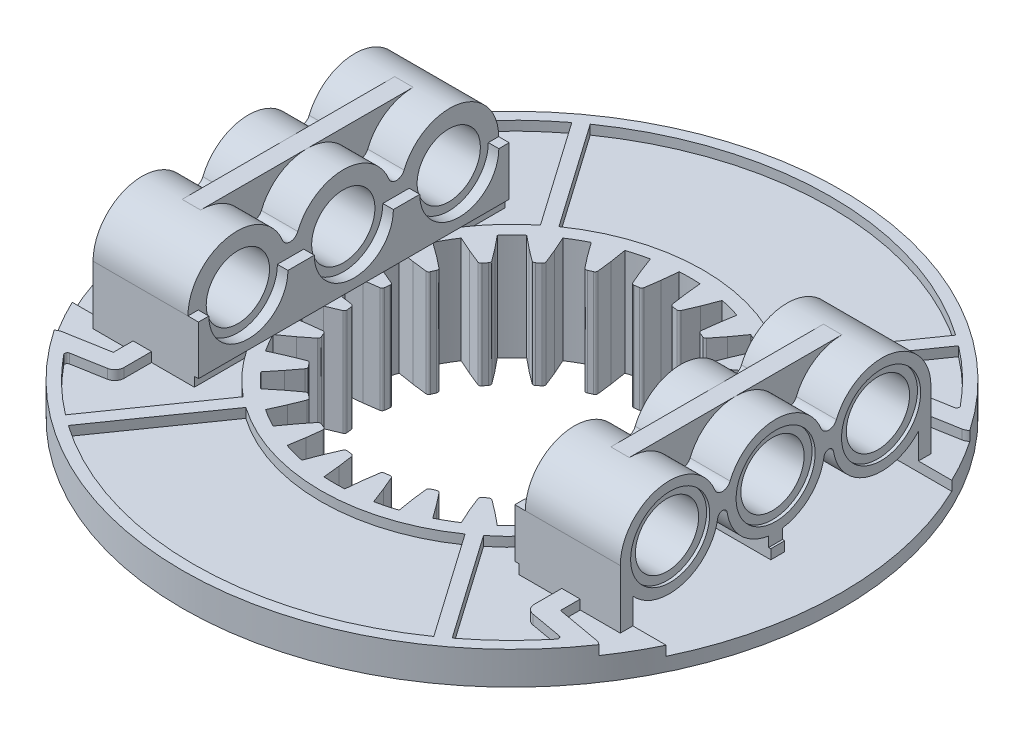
SolidWorks part; units mm, degrees
ref_plane "정면" through (0, 0, 0) normal (0, 0, 1) x (1, 0, 0)
ref_plane "윗면" through (0, 0, 0) normal (0, 1, 0) x (1, 0, 0)
ref_plane "우측면" through (0, 0, 0) normal (1, 0, 0) x (0, 0, -1)
imported_body "불러온 피처3"
sketch "스케치1" plane through (0, 6.21, 0) normal (0, 1, 0) x (-1, 0, 0)
  line L0 (-20.1625, -11.785) -> (-20.1625, 11.785)
  line L1 (-20.1625, 11.785) -> (-16.9625, 11.785)
  line L2 (-16.9625, 11.785) -> (-16.9625, 13.285)
  line L3 (-16.9625, 13.285) -> (-20.2821, 13.8745)
  line L4 (-20.7271, 14.9737) -> (-22.2268, 14.9737)
  line L5 (-22.2268, -14.9737) -> (-20.7271, -14.9737)
  line L6 (-20.2821, -13.8745) -> (-16.9625, -13.285)
  line L7 (-16.9625, -13.285) -> (-16.9625, -11.785)
  line L8 (-16.9625, -11.785) -> (-20.1625, -11.785)
  arc A0 (-20.2821, 13.8745) -> (-20.7271, 14.9737) centre (-20.1597, 14.5637) cw
  arc A1 (-22.2268, 14.9737) -> (-22.2268, -14.9737) centre (0, 0) ccw
  arc A2 (-20.7271, -14.9737) -> (-20.2821, -13.8745) centre (-20.1597, -14.5637) cw
extrude "컷-돌출1" cut sketch "스케치1" against normal blind 4.44
sketch "스케치2" plane through (0, 6.21, 0) normal (0, 1, 0) x (-1, 0, 0)
  line L0 (20.2821, 13.8745) -> (16.9625, 13.285)
  line L1 (16.9625, 13.285) -> (16.9625, 11.785)
  line L2 (16.9625, 11.785) -> (20.1625, 11.785)
  line L3 (20.1625, 11.785) -> (20.1625, -11.785)
  line L4 (20.1625, -11.785) -> (16.9625, -11.785)
  line L5 (16.9625, -11.785) -> (16.9625, -13.285)
  line L6 (16.9625, -13.285) -> (20.2821, -13.8745)
  line L7 (20.7271, -14.9737) -> (22.2268, -14.9737)
  line L8 (22.2268, 14.9737) -> (20.7271, 14.9737)
  arc A0 (20.7271, 14.9737) -> (20.2821, 13.8745) centre (20.1597, 14.5637) cw
  arc A1 (20.2821, -13.8745) -> (20.7271, -14.9737) centre (20.1597, -14.5637) cw
  arc A2 (22.2268, -14.9737) -> (22.2268, 14.9737) centre (0, 0) ccw
extrude "컷-돌출2" cut sketch "스케치2" against normal blind 4.44
sketch "스케치3" plane through (0, 6.21, 0) normal (0, 1, 0) x (-1, 0, 0)
  line L0 (-12.3125, -4.1719) -> (-12.3125, -11.785)
  line L1 (-12.3125, -11.785) -> (-16.9625, -11.785)
  line L2 (-16.9625, -11.785) -> (-16.9625, -13.285)
  line L3 (-16.9625, -13.285) -> (-20.2821, -13.8745)
  line L4 (-20.7271, -14.9737) -> (-22.2268, -14.9737)
  line L5 (22.2268, -14.9737) -> (20.7271, -14.9737)
  line L6 (20.2821, -13.8745) -> (16.9625, -13.285)
  line L7 (16.9625, -13.285) -> (16.9625, -11.785)
  line L8 (16.9625, -11.785) -> (12.3125, -11.785)
  line L9 (12.3125, -11.785) -> (12.3125, -4.1719)
  line L10 (12.3125, -4.1719) -> (11.5606, -4.0516)
  line L11 (11.5606, -4.0516) -> (10.2898, -3.895)
  line L12 (10.2898, -3.895) -> (10.0367, -4.521)
  line L13 (10.0367, -4.521) -> (11.0395, -5.3096)
  line L14 (11.0395, -5.3096) -> (12.0667, -6.0535)
  line L15 (11.2758, -7.4233) -> (10.118, -6.9057)
  line L16 (10.118, -6.9057) -> (8.9311, -6.4255)
  line L17 (8.9311, -6.4255) -> (8.5246, -6.9647)
  line L18 (8.5246, -6.9647) -> (9.2891, -7.9859)
  line L19 (9.2891, -7.9859) -> (10.0888, -8.9703)
  line L20 (8.9703, -10.0888) -> (7.9859, -9.2891)
  line L21 (7.9859, -9.2891) -> (6.9638, -8.5181)
  line L22 (6.9638, -8.5181) -> (6.4315, -8.9337)
  line L23 (6.4315, -8.9337) -> (6.9057, -10.118)
  line L24 (6.9057, -10.118) -> (7.4233, -11.2758)
  line L25 (6.0535, -12.0667) -> (5.3096, -11.0395)
  line L26 (5.3096, -11.0395) -> (4.5218, -10.0302)
  line L27 (4.5218, -10.0302) -> (3.9002, -10.2939)
  line L28 (3.9002, -10.2939) -> (4.0516, -11.5606)
  line L29 (4.0516, -11.5606) -> (4.252, -12.8129)
  line L30 (2.7242, -13.2223) -> (2.2715, -12.0376)
  line L31 (2.2715, -12.0376) -> (1.7717, -10.8588)
  line L32 (1.7717, -10.8588) -> (1.103, -10.9526)
  line L33 (1.103, -10.9526) -> (0.9215, -12.2153)
  line L34 (0.9215, -12.2153) -> (0.7908, -13.4768)
  line L35 (-0.7908, -13.4768) -> (-0.9215, -12.2153)
  line L36 (-0.9215, -12.2153) -> (-1.0991, -10.9473)
  line L37 (-1.0991, -10.9473) -> (-1.7693, -10.8649)
  line L38 (-1.7693, -10.8649) -> (-2.2715, -12.0376)
  line L39 (-2.2715, -12.0376) -> (-2.7242, -13.2223)
  line L40 (-4.252, -12.8129) -> (-4.0516, -11.5606)
  line L41 (-4.0516, -11.5606) -> (-3.895, -10.2898)
  line L42 (-3.895, -10.2898) -> (-4.521, -10.0367)
  line L43 (-4.521, -10.0367) -> (-5.3096, -11.0395)
  line L44 (-5.3096, -11.0395) -> (-6.0535, -12.0667)
  line L45 (-7.4233, -11.2758) -> (-6.9057, -10.118)
  line L46 (-6.9057, -10.118) -> (-6.4255, -8.9311)
  line L47 (-6.4255, -8.9311) -> (-6.9647, -8.5246)
  line L48 (-6.9647, -8.5246) -> (-7.9859, -9.2891)
  line L49 (-7.9859, -9.2891) -> (-8.9703, -10.0888)
  line L50 (-10.0888, -8.9703) -> (-9.2891, -7.9859)
  line L51 (-9.2891, -7.9859) -> (-8.5181, -6.9638)
  line L52 (-8.5181, -6.9638) -> (-8.9337, -6.4315)
  line L53 (-8.9337, -6.4315) -> (-10.118, -6.9057)
  line L54 (-10.118, -6.9057) -> (-11.2758, -7.4233)
  line L55 (-12.0667, -6.0535) -> (-11.0395, -5.3096)
  line L56 (-11.0395, -5.3096) -> (-10.0302, -4.5218)
  line L57 (-10.0302, -4.5218) -> (-10.2939, -3.9002)
  line L58 (-10.2939, -3.9002) -> (-11.5606, -4.0516)
  line L59 (-11.5606, -4.0516) -> (-12.3125, -4.1719)
  arc A0 (-20.2821, -13.8745) -> (-20.7271, -14.9737) centre (-20.1597, -14.5637) ccw
  arc A1 (-22.2268, -14.9737) -> (22.2268, -14.9737) centre (0, 0) ccw
  arc A2 (20.7271, -14.9737) -> (20.2821, -13.8745) centre (20.1597, -14.5637) ccw
  arc A3 (12.0667, -6.0535) -> (11.2758, -7.4233) centre (0, 0) cw
  arc A4 (10.0888, -8.9703) -> (8.9703, -10.0888) centre (0, 0) cw
  arc A5 (7.4233, -11.2758) -> (6.0535, -12.0667) centre (0, 0) cw
  arc A6 (4.252, -12.8129) -> (2.7242, -13.2223) centre (0, 0) cw
  arc A7 (0.7908, -13.4768) -> (-0.7908, -13.4768) centre (0, 0) cw
  arc A8 (-2.7242, -13.2223) -> (-4.252, -12.8129) centre (0, 0) cw
  arc A9 (-6.0535, -12.0667) -> (-7.4233, -11.2758) centre (0, 0) cw
  arc A10 (-8.9703, -10.0888) -> (-10.0888, -8.9703) centre (0, 0) cw
  arc A11 (-11.2758, -7.4233) -> (-12.0667, -6.0535) centre (0, 0) cw
extrude "컷-돌출3" cut sketch "스케치3" against normal blind 3.72
sketch "스케치4" plane through (0, 6.21, 0) normal (0, 1, 0) x (-1, 0, 0)
  line L0 (-16.9625, 11.785) -> (-12.3125, 11.785)
  line L1 (-12.3125, 11.785) -> (-12.3125, 4.1719)
  line L2 (-12.3125, 4.1719) -> (-11.5606, 4.0516)
  line L3 (-11.5606, 4.0516) -> (-10.2898, 3.895)
  line L4 (-10.2898, 3.895) -> (-10.0367, 4.521)
  line L5 (-10.0367, 4.521) -> (-11.0395, 5.3096)
  line L6 (-11.0395, 5.3096) -> (-12.0667, 6.0535)
  line L7 (-11.2758, 7.4233) -> (-10.118, 6.9057)
  line L8 (-10.118, 6.9057) -> (-8.9311, 6.4255)
  line L9 (-8.9311, 6.4255) -> (-8.5246, 6.9647)
  line L10 (-8.5246, 6.9647) -> (-9.2891, 7.9859)
  line L11 (-9.2891, 7.9859) -> (-10.0888, 8.9703)
  line L12 (-8.9703, 10.0888) -> (-7.9859, 9.2891)
  line L13 (-7.9859, 9.2891) -> (-6.9638, 8.5181)
  line L14 (-6.9638, 8.5181) -> (-6.4315, 8.9337)
  line L15 (-6.4315, 8.9337) -> (-6.9057, 10.118)
  line L16 (-6.9057, 10.118) -> (-7.4233, 11.2758)
  line L17 (-6.0535, 12.0667) -> (-5.3096, 11.0395)
  line L18 (-5.3096, 11.0395) -> (-4.5218, 10.0302)
  line L19 (-4.5218, 10.0302) -> (-3.9002, 10.2939)
  line L20 (-3.9002, 10.2939) -> (-4.0516, 11.5606)
  line L21 (-4.0516, 11.5606) -> (-4.252, 12.8129)
  line L22 (-2.7242, 13.2223) -> (-2.2715, 12.0376)
  line L23 (-2.2715, 12.0376) -> (-1.7717, 10.8588)
  line L24 (-1.7717, 10.8588) -> (-1.103, 10.9526)
  line L25 (-1.103, 10.9526) -> (-0.9215, 12.2153)
  line L26 (-0.9215, 12.2153) -> (-0.7908, 13.4768)
  line L27 (0.7908, 13.4768) -> (0.9215, 12.2153)
  line L28 (0.9215, 12.2153) -> (1.0991, 10.9473)
  line L29 (1.0991, 10.9473) -> (1.7693, 10.8649)
  line L30 (1.7693, 10.8649) -> (2.2715, 12.0376)
  line L31 (2.2715, 12.0376) -> (2.7242, 13.2223)
  line L32 (4.252, 12.8129) -> (4.0516, 11.5606)
  line L33 (4.0516, 11.5606) -> (3.895, 10.2898)
  line L34 (3.895, 10.2898) -> (4.521, 10.0367)
  line L35 (4.521, 10.0367) -> (5.3096, 11.0395)
  line L36 (5.3096, 11.0395) -> (6.0535, 12.0667)
  line L37 (7.4233, 11.2758) -> (6.9057, 10.118)
  line L38 (6.9057, 10.118) -> (6.4255, 8.9311)
  line L39 (6.4255, 8.9311) -> (6.9647, 8.5246)
  line L40 (6.9647, 8.5246) -> (7.9859, 9.2891)
  line L41 (7.9859, 9.2891) -> (8.9703, 10.0888)
  line L42 (10.0888, 8.9703) -> (9.2891, 7.9859)
  line L43 (9.2891, 7.9859) -> (8.5181, 6.9638)
  line L44 (8.5181, 6.9638) -> (8.9337, 6.4315)
  line L45 (8.9337, 6.4315) -> (10.118, 6.9057)
  line L46 (10.118, 6.9057) -> (11.2758, 7.4233)
  line L47 (12.0667, 6.0535) -> (11.0395, 5.3096)
  line L48 (11.0395, 5.3096) -> (10.0302, 4.5218)
  line L49 (10.0302, 4.5218) -> (10.2939, 3.9002)
  line L50 (10.2939, 3.9002) -> (11.5606, 4.0516)
  line L51 (11.5606, 4.0516) -> (12.3125, 4.1719)
  line L52 (12.3125, 4.1719) -> (12.3125, 11.785)
  line L53 (12.3125, 11.785) -> (16.9625, 11.785)
  line L54 (16.9625, 11.785) -> (16.9625, 13.285)
  line L55 (16.9625, 13.285) -> (20.2821, 13.8745)
  line L56 (20.7271, 14.9737) -> (22.2268, 14.9737)
  line L57 (-22.2268, 14.9737) -> (-20.7271, 14.9737)
  line L58 (-20.2821, 13.8745) -> (-16.9625, 13.285)
  line L59 (-16.9625, 13.285) -> (-16.9625, 11.785)
  arc A0 (-12.0667, 6.0535) -> (-11.2758, 7.4233) centre (0, 0) cw
  arc A1 (-10.0888, 8.9703) -> (-8.9703, 10.0888) centre (0, 0) cw
  arc A2 (-7.4233, 11.2758) -> (-6.0535, 12.0667) centre (0, 0) cw
  arc A3 (-4.252, 12.8129) -> (-2.7242, 13.2223) centre (0, 0) cw
  arc A4 (-0.7908, 13.4768) -> (0.7908, 13.4768) centre (0, 0) cw
  arc A5 (2.7242, 13.2223) -> (4.252, 12.8129) centre (0, 0) cw
  arc A6 (6.0535, 12.0667) -> (7.4233, 11.2758) centre (0, 0) cw
  arc A7 (8.9703, 10.0888) -> (10.0888, 8.9703) centre (0, 0) cw
  arc A8 (11.2758, 7.4233) -> (12.0667, 6.0535) centre (0, 0) cw
  arc A9 (20.2821, 13.8745) -> (20.7271, 14.9737) centre (20.1597, 14.5637) ccw
  arc A10 (22.2268, 14.9737) -> (-22.2268, 14.9737) centre (0, 0) ccw
  arc A11 (-20.7271, 14.9737) -> (-20.2821, 13.8745) centre (-20.1597, 14.5637) ccw
extrude "컷-돌출4" cut sketch "스케치4" against normal blind 3.72
sketch "스케치5" plane through (0, -5.575, 0) normal (0, -1, 0) x (1, 0, 0)
  line L0 (12.8129, 4.252) -> (12.3125, 4.1719)
  line L1 (12.3125, 4.1719) -> (12.3125, 2.3765)
  line L2 (12.3125, 2.3765) -> (13.2223, 2.7242)
  arc A0 (13.2223, 2.7242) -> (12.8129, 4.252) centre (0, 0) ccw
extrude "컷-돌출5" cut sketch "스케치5" against normal blind 8.065
sketch "스케치6" plane through (-12.3125, 0, 0) normal (1, 0, 0) x (0, 0, -1)
  line L0 (0, 9.93) -> (-8.065, 9.93)
  arc A0 (-8.065, 9.93) -> (-4.6127, 7.5956) centre (-8.065, 6.21) cw
  arc A1 (-4.6127, 7.5956) -> (-3.4523, 7.5956) centre (-4.0325, 7.8285) ccw
  arc A2 (-3.4523, 7.5956) -> (0, 9.93) centre (0, 6.21) cw
extrude "컷-돌출6" cut sketch "스케치6" against normal blind 3.25
sketch "스케치7" plane through (12.3125, 0, 0) normal (-1, 0, 0) x (0, 0, 1)
  line L0 (8.065, 9.93) -> (0, 9.93)
  arc A0 (4.6127, 7.5956) -> (8.065, 9.93) centre (8.065, 6.21) cw
  arc A1 (0, 9.93) -> (3.4523, 7.5956) centre (0, 6.21) cw
  arc A2 (3.4523, 7.5956) -> (4.6127, 7.5956) centre (4.0325, 7.8285) ccw
extrude "컷-돌출7" cut sketch "스케치7" against normal blind 3.25
sketch "스케치8" plane through (20.1625, 0, 0) normal (1, 0, 0) x (0, 0, -1)
  line L0 (0, 9.93) -> (-8.065, 9.93)
  arc A0 (-8.065, 9.93) -> (-4.6127, 7.5956) centre (-8.065, 6.21) cw
  arc A1 (-4.6127, 7.5956) -> (-3.4523, 7.5956) centre (-4.0325, 7.8285) ccw
  arc A2 (-3.4523, 7.5956) -> (0, 9.93) centre (0, 6.21) cw
extrude "컷-돌출8" cut sketch "스케치8" against normal blind 3.2
sketch "스케치9" plane through (-12.3125, 0, 0) normal (1, 0, 0) x (0, 0, -1)
  line L0 (8.065, 9.93) -> (0, 9.93)
  arc A0 (0, 9.93) -> (3.4523, 7.5956) centre (0, 6.21) cw
  arc A1 (3.4523, 7.5956) -> (4.6127, 7.5956) centre (4.0325, 7.8285) ccw
  arc A2 (4.6127, 7.5956) -> (8.065, 9.93) centre (8.065, 6.21) cw
extrude "컷-돌출9" cut sketch "스케치9" against normal blind 3.25
sketch "스케치10" plane through (-20.1625, 0, 0) normal (-1, 0, 0) x (0, 0, 1)
  line L0 (0, 9.93) -> (-8.065, 9.93)
  arc A0 (-3.4523, 7.5956) -> (0, 9.93) centre (0, 6.21) cw
  arc A1 (-8.065, 9.93) -> (-4.6127, 7.5956) centre (-8.065, 6.21) cw
  arc A2 (-4.6127, 7.5956) -> (-3.4523, 7.5956) centre (-4.0325, 7.8285) ccw
extrude "컷-돌출10" cut sketch "스케치10" against normal blind 3.2
sketch "스케치11" plane through (20.1625, 0, 0) normal (1, 0, 0) x (0, 0, -1)
  line L0 (8.065, 9.93) -> (0, 9.93)
  arc A0 (0, 9.93) -> (3.4523, 7.5956) centre (0, 6.21) cw
  arc A1 (3.4523, 7.5956) -> (4.6127, 7.5956) centre (4.0325, 7.8285) ccw
  arc A2 (4.6127, 7.5956) -> (8.065, 9.93) centre (8.065, 6.21) cw
extrude "컷-돌출11" cut sketch "스케치11" against normal blind 3.2
sketch "스케치12" plane through (12.3125, 0, 0) normal (-1, 0, 0) x (0, 0, 1)
  line L0 (0, 9.93) -> (-8.065, 9.93)
  arc A0 (-3.4523, 7.5956) -> (0, 9.93) centre (0, 6.21) cw
  arc A1 (-8.065, 9.93) -> (-4.6127, 7.5956) centre (-8.065, 6.21) cw
  arc A2 (-4.6127, 7.5956) -> (-3.4523, 7.5956) centre (-4.0325, 7.8285) ccw
extrude "컷-돌출12" cut sketch "스케치12" against normal blind 3.25
sketch "스케치13" plane through (0, -5.575, 0) normal (0, -1, 0) x (1, 0, 0)
  line L0 (13.4768, 0.7908) -> (12.3125, 0.9114)
  line L1 (12.3125, 0.9114) -> (12.3125, -0.9114)
  line L2 (12.3125, -0.9114) -> (13.4768, -0.7908)
  arc A0 (13.4768, -0.7908) -> (13.4768, 0.7908) centre (0, 0) ccw
extrude "컷-돌출13" cut sketch "스케치13" against normal blind 8.065
sketch "스케치14" plane through (0, -5.575, 0) normal (0, -1, 0) x (1, 0, 0)
  line L0 (13.2223, -2.7242) -> (12.3125, -2.3765)
  line L1 (12.3125, -2.3765) -> (12.3125, -4.1719)
  line L2 (12.3125, -4.1719) -> (12.8129, -4.252)
  arc A0 (12.8129, -4.252) -> (13.2223, -2.7242) centre (0, 0) ccw
extrude "컷-돌출14" cut sketch "스케치14" against normal blind 8.065
sketch "스케치15" plane through (0, -5.575, 0) normal (0, -1, 0) x (1, 0, 0)
  line L0 (-12.8129, -4.252) -> (-12.3125, -4.1719)
  line L1 (-12.3125, -4.1719) -> (-12.3125, -2.3765)
  line L2 (-12.3125, -2.3765) -> (-13.2223, -2.7242)
  arc A0 (-13.2223, -2.7242) -> (-12.8129, -4.252) centre (0, 0) ccw
extrude "컷-돌출15" cut sketch "스케치15" against normal blind 8.065
sketch "스케치16" plane through (0, -5.575, 0) normal (0, -1, 0) x (1, 0, 0)
  line L0 (-13.4768, -0.7908) -> (-12.3125, -0.9114)
  line L1 (-12.3125, -0.9114) -> (-12.3125, 0.9114)
  line L2 (-12.3125, 0.9114) -> (-13.4768, 0.7908)
  arc A0 (-13.4768, 0.7908) -> (-13.4768, -0.7908) centre (0, 0) ccw
extrude "컷-돌출16" cut sketch "스케치16" against normal blind 8.065
sketch "스케치17" plane through (0, -5.575, 0) normal (0, -1, 0) x (1, 0, 0)
  line L0 (-13.2223, 2.7242) -> (-12.3125, 2.3765)
  line L1 (-12.3125, 2.3765) -> (-12.3125, 4.1719)
  line L2 (-12.3125, 4.1719) -> (-12.8129, 4.252)
  arc A0 (-12.8129, 4.252) -> (-13.2223, 2.7242) centre (0, 0) ccw
extrude "컷-돌출17" cut sketch "스케치17" against normal blind 8.065
sketch "스케치18" plane through (-20.1625, 0, 0) normal (-1, 0, 0) x (0, 0, 1)
  line L0 (8.065, 9.93) -> (0, 9.93)
  arc A0 (4.6127, 7.5956) -> (8.065, 9.93) centre (8.065, 6.21) cw
  arc A1 (0, 9.93) -> (3.4523, 7.5956) centre (0, 6.21) cw
  arc A2 (3.4523, 7.5956) -> (4.6127, 7.5956) centre (4.0325, 7.8285) ccw
extrude "컷-돌출18" cut sketch "스케치18" against normal blind 3.2
sketch "스케치19" plane through (-12.3125, 0, 0) normal (1, 0, 0) x (0, 0, -1)
  line L0 (-11.7086, 6.96) -> (11.7086, 6.96)
  arc A0 (-4.6127, 7.5956) -> (-11.7086, 6.96) centre (-8.065, 6.21) ccw
  arc A1 (11.7086, 6.96) -> (4.6127, 7.5956) centre (8.065, 6.21) ccw
  arc A2 (4.6127, 7.5956) -> (3.4523, 7.5956) centre (4.0325, 7.8285) cw
  arc A3 (3.4523, 7.5956) -> (-3.4523, 7.5956) centre (0, 6.21) ccw
  arc A4 (-3.4523, 7.5956) -> (-4.6127, 7.5956) centre (-4.0325, 7.8285) cw
extrude "컷-돌출19" cut sketch "스케치19" against normal blind 0.0875
sketch "스케치20" plane through (12.3125, 0, 0) normal (-1, 0, 0) x (0, 0, 1)
  line L0 (-11.7086, 6.96) -> (11.7086, 6.96)
  arc A0 (-4.6127, 7.5956) -> (-11.7086, 6.96) centre (-8.065, 6.21) ccw
  arc A1 (11.7086, 6.96) -> (4.6127, 7.5956) centre (8.065, 6.21) ccw
  arc A2 (4.6127, 7.5956) -> (3.4523, 7.5956) centre (4.0325, 7.8285) cw
  arc A3 (3.4523, 7.5956) -> (-3.4523, 7.5956) centre (0, 6.21) ccw
  arc A4 (-3.4523, 7.5956) -> (-4.6127, 7.5956) centre (-4.0325, 7.8285) cw
extrude "컷-돌출20" cut sketch "스케치20" against normal blind 0.0875
sketch "스케치21" plane through (0, 2.49, 0) normal (0, 1, 0) x (-1, 0, 0)
  line L0 (-14.6706, -19.2084) -> (-9.1162, -11.2758)
  line L1 (-12.3125, -7.6585) -> (-12.3125, -11.785)
  line L2 (-12.3125, -11.785) -> (-15.5625, -11.785)
  line L3 (-15.5625, -11.785) -> (-15.5625, -14.4583)
  line L4 (-15.5625, -14.4583) -> (-18.577, -14.9936)
  arc A0 (-18.6968, -15.3173) -> (-14.6706, -19.2084) centre (0, 0) ccw
  arc A1 (-9.1162, -11.2758) -> (-12.3125, -7.6585) centre (0, 0) cw
  arc A2 (-18.577, -14.9936) -> (-18.6968, -15.3173) centre (-18.5421, -15.1905) ccw
extrude "컷-돌출21" cut sketch "스케치21" against normal blind 0.72
sketch "스케치22" plane through (0, 2.49, 0) normal (0, 1, 0) x (-1, 0, 0)
  line L0 (-18.577, 14.9936) -> (-15.5625, 14.4583)
  line L1 (-15.5625, 14.4583) -> (-15.5625, 11.785)
  line L2 (-15.5625, 11.785) -> (-12.3125, 11.785)
  line L3 (-12.3125, 11.785) -> (-12.3125, 7.6585)
  line L4 (-9.1162, 11.2758) -> (-14.6706, 19.2084)
  arc A0 (-14.6706, 19.2084) -> (-18.6968, 15.3173) centre (0, 0) ccw
  arc A1 (-18.6968, 15.3173) -> (-18.577, 14.9936) centre (-18.5421, 15.1905) ccw
  arc A2 (-12.3125, 7.6585) -> (-9.1162, 11.2758) centre (0, 0) cw
extrude "컷-돌출22" cut sketch "스케치22" against normal blind 0.72
sketch "스케치23" plane through (0, 2.49, 0) normal (0, 1, 0) x (-1, 0, 0)
  line L0 (12.3125, 11.785) -> (15.5625, 11.785)
  line L1 (15.5625, 11.785) -> (15.5625, 14.4583)
  line L2 (15.5625, 14.4583) -> (18.577, 14.9936)
  line L3 (14.6706, 19.2084) -> (9.1162, 11.2758)
  line L4 (12.3125, 7.6585) -> (12.3125, 11.785)
  arc A0 (18.577, 14.9936) -> (18.6968, 15.3173) centre (18.5421, 15.1905) ccw
  arc A1 (18.6968, 15.3173) -> (14.6706, 19.2084) centre (0, 0) ccw
  arc A2 (9.1162, 11.2758) -> (12.3125, 7.6585) centre (0, 0) cw
extrude "컷-돌출23" cut sketch "스케치23" against normal blind 0.72
sketch "스케치24" plane through (0, 2.49, 0) normal (0, 1, 0) x (-1, 0, 0)
  line L0 (15.5625, -11.785) -> (12.3125, -11.785)
  line L1 (12.3125, -11.785) -> (12.3125, -7.6585)
  line L2 (9.1162, -11.2758) -> (14.6706, -19.2084)
  line L3 (18.577, -14.9936) -> (15.5625, -14.4583)
  line L4 (15.5625, -14.4583) -> (15.5625, -11.785)
  arc A0 (12.3125, -7.6585) -> (9.1162, -11.2758) centre (0, 0) cw
  arc A1 (14.6706, -19.2084) -> (18.6968, -15.3173) centre (0, 0) ccw
  arc A2 (18.6968, -15.3173) -> (18.577, -14.9936) centre (18.5421, -15.1905) ccw
extrude "컷-돌출24" cut sketch "스케치24" against normal blind 0.72
sketch "스케치25" plane through (0, 1.77, 0) normal (0, 1, 0) x (-1, 0, 0)
  line L0 (-20.1625, -10.835) -> (-20.1625, 10.835)
  line L1 (-20.1625, 10.835) -> (-24.5121, 10.835)
  line L2 (-24.5121, -10.835) -> (-20.1625, -10.835)
  arc A0 (-24.5121, 10.835) -> (-24.5121, -10.835) centre (0, 0) ccw
extrude "컷-돌출25" cut sketch "스케치25" against normal blind 0.73
sketch "스케치26" plane through (20.1625, 0, 0) normal (1, 0, 0) x (0, 0, -1)
  line L0 (-10.835, 1.04) -> (-0.53, 1.04)
  line L1 (-0.53, 1.04) -> (-0.53, 2.5279)
  line L2 (-10.835, 3.727) -> (-10.835, 1.04)
  arc A0 (-0.53, 2.5279) -> (-3.6768, 5.6448) centre (0, 6.21) cw
  arc A1 (-3.6768, 5.6448) -> (-4.3882, 5.6448) centre (-4.0325, 5.5901) ccw
  arc A2 (-4.3882, 5.6448) -> (-10.835, 3.727) centre (-8.065, 6.21) cw
extrude "컷-돌출26" cut sketch "스케치26" against normal blind 6
sketch "스케치27" plane through (20.1625, 0, 0) normal (1, 0, 0) x (0, 0, -1)
  line L0 (0.53, 1.04) -> (10.835, 1.04)
  line L1 (10.835, 1.04) -> (10.835, 3.727)
  line L2 (0.53, 2.5279) -> (0.53, 1.04)
  arc A0 (10.835, 3.727) -> (4.3882, 5.6448) centre (8.065, 6.21) cw
  arc A1 (4.3882, 5.6448) -> (3.6768, 5.6448) centre (4.0325, 5.5901) ccw
  arc A2 (3.6768, 5.6448) -> (0.53, 2.5279) centre (0, 6.21) cw
extrude "컷-돌출27" cut sketch "스케치27" against normal blind 6
sketch "스케치28" plane through (0, 1.77, 0) normal (0, 1, 0) x (-1, 0, 0)
  line L0 (24.5121, 10.835) -> (20.1625, 10.835)
  line L1 (20.1625, 10.835) -> (20.1625, -10.835)
  line L2 (20.1625, -10.835) -> (24.5121, -10.835)
  arc A0 (24.5121, -10.835) -> (24.5121, 10.835) centre (0, 0) ccw
extrude "컷-돌출28" cut sketch "스케치28" against normal blind 0.73
sketch "스케치29" plane through (-20.1625, 0, 0) normal (-1, 0, 0) x (0, 0, 1)
  line L0 (0.53, 2.5279) -> (0.53, 1.04)
  line L1 (0.53, 1.04) -> (10.835, 1.04)
  line L2 (10.835, 1.04) -> (10.835, 3.727)
  arc A0 (10.835, 3.727) -> (4.3882, 5.6448) centre (8.065, 6.21) cw
  arc A1 (4.3882, 5.6448) -> (3.6768, 5.6448) centre (4.0325, 5.5901) ccw
  arc A2 (3.6768, 5.6448) -> (0.53, 2.5279) centre (0, 6.21) cw
extrude "컷-돌출29" cut sketch "스케치29" against normal blind 6
sketch "스케치30" plane through (-20.1625, 0, 0) normal (-1, 0, 0) x (0, 0, 1)
  line L0 (-10.835, 1.04) -> (-0.53, 1.04)
  line L1 (-0.53, 1.04) -> (-0.53, 2.5279)
  line L2 (-10.835, 3.727) -> (-10.835, 1.04)
  arc A0 (-0.53, 2.5279) -> (-3.6768, 5.6448) centre (0, 6.21) cw
  arc A1 (-3.6768, 5.6448) -> (-4.3882, 5.6448) centre (-4.0325, 5.5901) ccw
  arc A2 (-4.3882, 5.6448) -> (-10.835, 3.727) centre (-8.065, 6.21) cw
extrude "컷-돌출30" cut sketch "스케치30" against normal blind 6
sketch "스케치31" plane through (-12.3125, 0, 0) normal (1, 0, 0) x (0, 0, -1)
  line L0 (-4.6463, 6.96) -> (-11.4837, 6.96)
  arc A0 (-11.4837, 6.96) -> (-4.6463, 6.96) centre (-8.065, 6.21) ccw
extrude "컷-돌출31" cut sketch "스케치31" against normal blind 0.0875
sketch "스케치32" plane through (-12.3125, 0, 0) normal (1, 0, 0) x (0, 0, -1)
  line L0 (2.9821, 6.96) -> (-2.9821, 6.96)
  arc A0 (-2.9821, 6.96) -> (2.9821, 6.96) centre (0, 6.21) ccw
extrude "컷-돌출32" cut sketch "스케치32" against normal blind 0.0875
sketch "스케치33" plane through (-12.3125, 0, 0) normal (1, 0, 0) x (0, 0, -1)
  line L0 (11.4837, 6.96) -> (4.6463, 6.96)
  arc A0 (4.6463, 6.96) -> (11.4837, 6.96) centre (8.065, 6.21) ccw
extrude "컷-돌출33" cut sketch "스케치33" against normal blind 0.0875
sketch "스케치34" plane through (12.3125, 0, 0) normal (-1, 0, 0) x (0, 0, 1)
  line L0 (-4.6463, 6.96) -> (-11.4837, 6.96)
  arc A0 (-11.4837, 6.96) -> (-4.6463, 6.96) centre (-8.065, 6.21) ccw
extrude "컷-돌출34" cut sketch "스케치34" against normal blind 0.0875
sketch "스케치35" plane through (12.3125, 0, 0) normal (-1, 0, 0) x (0, 0, 1)
  line L0 (2.9821, 6.96) -> (-2.9821, 6.96)
  arc A0 (-2.9821, 6.96) -> (2.9821, 6.96) centre (0, 6.21) ccw
extrude "컷-돌출35" cut sketch "스케치35" against normal blind 0.0875
sketch "스케치36" plane through (12.3125, 0, 0) normal (-1, 0, 0) x (0, 0, 1)
  line L0 (11.4837, 6.96) -> (4.6463, 6.96)
  arc A0 (4.6463, 6.96) -> (11.4837, 6.96) centre (8.065, 6.21) ccw
extrude "컷-돌출36" cut sketch "스케치36" against normal blind 0.0875
sketch "스케치37" plane through (0, 1.04, 0) normal (0, 1, 0) x (-1, 0, 0)
  line L0 (-14.1625, 3.1102) -> (-14.1625, 0.53)
  line L1 (-14.1625, 0.53) -> (-14.4903, 0.53)
  arc A0 (-14.4903, 0.53) -> (-14.1625, 3.1102) centre (0, 0) cw
extrude "보스-돌출1" add sketch "스케치37" along normal blind 1.45
sketch "스케치38" plane through (0, 1.04, 0) normal (0, 1, 0) x (-1, 0, 0)
  line L0 (-14.4903, -0.53) -> (-14.1625, -0.53)
  line L1 (-14.1625, -0.53) -> (-14.1625, -3.1102)
  arc A0 (-14.1625, -3.1102) -> (-14.4903, -0.53) centre (0, 0) cw
extrude "보스-돌출2" add sketch "스케치38" along normal blind 1.45
sketch "스케치39" plane through (0, 1.04, 0) normal (0, 1, 0) x (-1, 0, 0)
  line L0 (14.4903, 0.53) -> (14.1625, 0.53)
  line L1 (14.1625, 0.53) -> (14.1625, 3.1102)
  arc A0 (14.1625, 3.1102) -> (14.4903, 0.53) centre (0, 0) cw
extrude "보스-돌출3" add sketch "스케치39" along normal blind 1.45
sketch "스케치40" plane through (0, 1.04, 0) normal (0, 1, 0) x (-1, 0, 0)
  line L0 (14.1625, -3.1102) -> (14.1625, -0.53)
  line L1 (14.1625, -0.53) -> (14.4903, -0.53)
  arc A0 (14.4903, -0.53) -> (14.1625, -3.1102) centre (0, 0) cw
extrude "보스-돌출4" add sketch "스케치40" along normal blind 1.45
sketch "스케치41" plane through (0, 2.49, 0) normal (0, 1, 0) x (-1, 0, 0)
  line L0 (-8.3169, -11.8777) -> (-13.8633, -19.7989)
  line L1 (13.8633, -19.7989) -> (8.3169, -11.8777)
  arc A0 (-13.8633, -19.7989) -> (13.8633, -19.7989) centre (0, 0) ccw
  arc A1 (8.3169, -11.8777) -> (-8.3169, -11.8777) centre (0, 0) cw
extrude "컷-돌출37" cut sketch "스케치41" against normal blind 0.72
sketch "스케치42" plane through (0, 2.49, 0) normal (0, 1, 0) x (-1, 0, 0)
  line L0 (8.3169, 11.8777) -> (13.8633, 19.7989)
  line L1 (-13.8633, 19.7989) -> (-8.3169, 11.8777)
  arc A0 (13.8633, 19.7989) -> (-13.8633, 19.7989) centre (0, 0) ccw
  arc A1 (-8.3169, 11.8777) -> (8.3169, 11.8777) centre (0, 0) cw
extrude "컷-돌출38" cut sketch "스케치42" against normal blind 0.72
hole_wizard "M4 육각 머리 작은 나사용 카운터보어1" positions "스케치44" profile "스케치43" counterbore size "M4" standard "Ansi Metric"
sketch "스케치44" plane through (20.1625, 0, 0) normal (1, 0, 0) x (0, 0, -1)
  point P0 (0, 6.21)
  point P1 (8, 6.21)
  point P2 (-8, 6.21)
  dimension "D1" = 8
  dimension "D2" = 8
sketch "스케치43" plane through (20.1625, 6.21, 0) normal (0, 1, 0) x (0, 0, -1)
  line L0 (0, 0) -> (0, 7.7625)
  line L1 (0, 7.7625) -> (2.4, 7.7625)
  line L3 (2.4, 7.7625) -> (2.4, 0.4)
  line L4 (2.4, 0.4) -> (3, 0.4)
  line L5 (3, 0.4) -> (3, 0)
  line L7 (3, 0) -> (0, 0)
  line L11 (0, -6.35) -> (0, 107.95) construction
  dimension "관통 구멍 지름" = 4.8
  dimension "관통 구멍 깊이" = 7.7625
  dimension "카운터보어 지름" = 6
  dimension "카운터보어 깊이" = 0.4
hole_wizard "M4 육각 머리 작은 나사용 카운터보어2" positions "스케치46" profile "스케치45" counterbore size "M4" standard "Ansi Metric"
sketch "스케치46" plane through (-20.1625, 0, 0) normal (-1, 0, 0) x (0, 0, 1)
  point P0 (0, 6.21)
  point P1 (-8, 6.21)
  point P2 (8, 6.21)
  dimension "D1" = 8
  dimension "D2" = 8
sketch "스케치45" plane through (-20.1625, 6.21, 0) normal (0, 1, 0) x (0, 0, 1)
  line L0 (0, 0) -> (0, 46.9625)
  line L1 (0, 46.9625) -> (2.4, 46.9625)
  line L3 (2.4, 46.9625) -> (2.4, 0.4)
  line L4 (2.4, 0.4) -> (3, 0.4)
  line L5 (3, 0.4) -> (3, 0)
  line L7 (3, 0) -> (0, 0)
  line L11 (0, -6.35) -> (0, 107.95) construction
  dimension "관통 구멍 지름" = 4.8
  dimension "관통 구멍 깊이" = 46.9625
  dimension "카운터보어 지름" = 6
  dimension "카운터보어 깊이" = 0.4
fillet "필렛1" radius 0.2 48 edges at (-3.9002, -1.5425, -10.2939) (-6.4315, -1.5425, -8.9337) (-1.103, -1.5425, -10.9526) (-10.9526, -1.5425, 1.103) (3.895, -1.5425, -10.2898) (-1.7693, -1.5425, 10.8649) (1.0991, -1.5425, -10.9473) (-10.9473, -1.5425, -1.0991) (-4.521, -1.5425, 10.0367) (-1.0991, -1.5425, 10.9473) (10.8588, -1.5425, -1.7717) (-10.8649, -1.5425, -1.7693) (10.9526, -1.5425, -1.103) (1.103, -1.5425, 10.9526) (10.9473, -1.5425, 1.0991) (-10.2898, -1.5425, -3.895) (10.8649, -1.5425, 1.7693) (1.7717, -1.5425, 10.8588) (-6.4255, -1.5425, 8.9311) (-10.0367, -1.5425, -4.521) (-3.895, -1.5425, 10.2898) (3.9002, -1.5425, 10.2939) (4.521, -1.5425, -10.0367) (8.5181, -1.5425, -6.9638) (8.5246, -1.5425, 6.9647) (-8.9311, -1.5425, -6.4255) (-4.5218, -1.5425, -10.0302) (8.9337, -1.5425, -6.4315) (8.9311, -1.5425, 6.4255) (4.5218, -1.5425, 10.0302) (1.7693, -1.5425, -10.8649) (-8.5246, -1.5425, -6.9647) (10.0367, -1.5425, 4.521) (6.9647, -1.5425, -8.5246) (-1.7717, -1.5425, -10.8588) (10.0302, -1.5425, -4.5218) (10.2898, -1.5425, 3.895) (-8.9337, -1.5425, 6.4315) (-10.0302, -1.5425, 4.5218) (-6.9647, -1.5425, 8.5246) (-10.2939, -1.5425, 3.9002) (-6.9638, -1.5425, -8.5181) (-10.8588, -1.5425, 1.7717) (10.2939, -1.5425, -3.9002) (6.9638, -1.5425, 8.5181) (6.4315, -1.5425, 8.9337) (-8.5181, -1.5425, 6.9638) (6.4255, -1.5425, -8.9311)
fillet "필렛2" radius 0.7 4 edges at (-15.5625, 2.13, -14.4583) (15.5625, 2.13, -14.4583) (15.5625, 2.13, 14.4583) (-15.5625, 2.13, 14.4583)
sketch "스케치47" plane through (0, 0, 0) normal (0, 1, 0) x (1, 0, 0)
  circle A0 centre (0, 0) radius 25
  circle A1 centre (0, 0) radius 26.8
  dimension "D1" = 50
extrude "컷-돌출39" cut sketch "스케치47" against normal through all both and the other way through all
ref_plane "Plane1" through (20, 0, 0) normal (1, 0, 0) x (0, 0, -1)
ref_plane "Plane2" through (-20, 0, 0) normal (1, 0, 0) x (0, 0, -1)
sketch "Sketch1" plane through (20, 0, 0) normal (1, 0, 0) x (0, 0, -1)
  line L1 (-11.785, 1.77) -> (11.785, 1.77)
  line L2 (-11.785, 1.77) -> (-11.785, 10.4334)
  line L3 (-11.785, 10.4334) -> (11.785, 10.4334)
  line L4 (11.785, 1.77) -> (11.785, 10.4334)
extrude "Cut-Extrude2" cut sketch "Sketch1" along normal up to surface (0.1625 mm away)
sketch "Sketch2" plane through (-20.1625, 0, 0) normal (-1, 0, 0) x (0, 0, 1)
  line L1 (-11.785, 1.77) -> (11.785, 1.77)
  line L2 (-11.785, 1.77) -> (-11.785, 10.2715)
  line L3 (-11.785, 10.2715) -> (11.785, 10.2715)
  line L4 (11.785, 1.77) -> (11.785, 10.2715)
extrude "Cut-Extrude3" cut sketch "Sketch2" against normal up to surface (0.1625 mm away)
ref_plane "Plane3" through (-12, 0, 0) normal (1, 0, 0) x (0, 0, -1)
ref_plane "Plane4" through (12, 0, 0) normal (1, 0, 0) x (0, 0, -1)
sketch "Sketch4" plane through (-12.4, 0, 0) normal (1, 0, 0) x (0, 0, -1)
  line L0 (-11.785, 6.21) -> (-11.785, 2.49)
  line L1 (-11.785, 2.49) -> (11.785, 2.49)
  line L2 (11.785, 2.49) -> (11.785, 6.21)
  arc A0 (-4.6127, 7.5956) -> (-11.785, 6.21) centre (-8.065, 6.21) ccw
  arc A1 (3.4523, 7.5956) -> (-3.4523, 7.5956) centre (0, 6.21) ccw
  arc A2 (11.785, 6.21) -> (4.6127, 7.5956) centre (8.065, 6.21) ccw
  arc A3 (3.4523, 7.5956) -> (4.6127, 7.5956) centre (4.0325, 7.8285) ccw
  arc A4 (-4.6127, 7.5956) -> (-3.4523, 7.5956) centre (-4.0325, 7.8285) ccw
extrude "Boss-Extrude1" add sketch "Sketch4" along normal up to surface (24.4 mm away)
sketch "Sketch5" plane through (-12, 0, 0) normal (1, 0, 0) x (0, 0, -1)
  circle A0 centre (-8, 6.21) radius 2.4
  circle A1 centre (0, 6.21) radius 2.4
  circle A2 centre (8, 6.21) radius 2.4
  dimension "D1" = 8
  dimension "D2" = 8
extrude "Cut-Extrude4" cut sketch "Sketch5" against normal through all
sketch "Sketch6" plane through (12.4, 0, 0) normal (-1, 0, 0) x (0, 0, 1)
  line L0 (-11.785, 6.21) -> (-11.785, 2.49)
  line L1 (-11.785, 2.49) -> (11.785, 2.49)
  line L2 (11.785, 6.21) -> (11.785, 2.49)
  arc A0 (-4.6127, 7.5956) -> (-11.785, 6.21) centre (-8.065, 6.21) ccw
  arc A1 (3.4523, 7.5956) -> (-3.4523, 7.5956) centre (0, 6.21) ccw
  arc A2 (11.785, 6.21) -> (4.6127, 7.5956) centre (8.065, 6.21) ccw
  arc A3 (-4.6127, 7.5956) -> (-3.4523, 7.5956) centre (-4.0325, 7.8285) ccw
  arc A4 (3.4523, 7.5956) -> (4.6127, 7.5956) centre (4.0325, 7.8285) ccw
extrude "Boss-Extrude2" add sketch "Sketch6" along normal up to surface (0.4 mm away)
sketch "Sketch7" plane through (12, 0, 0) normal (-1, 0, 0) x (0, 0, 1)
  circle A0 centre (-8, 6.21) radius 2.4
  circle A1 centre (0, 6.21) radius 2.4
  circle A2 centre (8, 6.21) radius 2.4
  dimension "D1" = 8
  dimension "D2" = 8
extrude "Cut-Extrude5" cut sketch "Sketch7" against normal through all
sketch "Sketch8" plane through (12, 0, 0) normal (-1, 0, 0) x (0, 0, 1)
  line L1 (-12.4613, 6.21) -> (-12.4613, 14.4586)
  line L2 (-12.4613, 14.4586) -> (11.065, 14.4586)
  line L7 (12.3701, 6.21) -> (12.3701, 14.4586)
  line L8 (12.3701, 14.4586) -> (11.065, 14.4586)
  line L9 (-5, 6.21) -> (-3, 6.21)
  line L10 (3, 6.21) -> (5, 6.21)
  line L11 (11, 6.21) -> (12.3701, 6.21)
  line L12 (-12.4613, 6.21) -> (-11, 6.21)
  arc A1 (-3, 6.21) -> (3, 6.21) centre (0, 6.21) ccw
  arc A3 (-11, 6.21) -> (-5, 6.21) centre (-8, 6.21) ccw
  arc A4 (5, 6.21) -> (11, 6.21) centre (8, 6.21) ccw
extrude "Cut-Extrude6" cut sketch "Sketch8" against normal blind 0.8
mirror "Mirror2" about plane through (0, 0, 0) normal (1, 0, 0) of "Cut-Extrude6"
